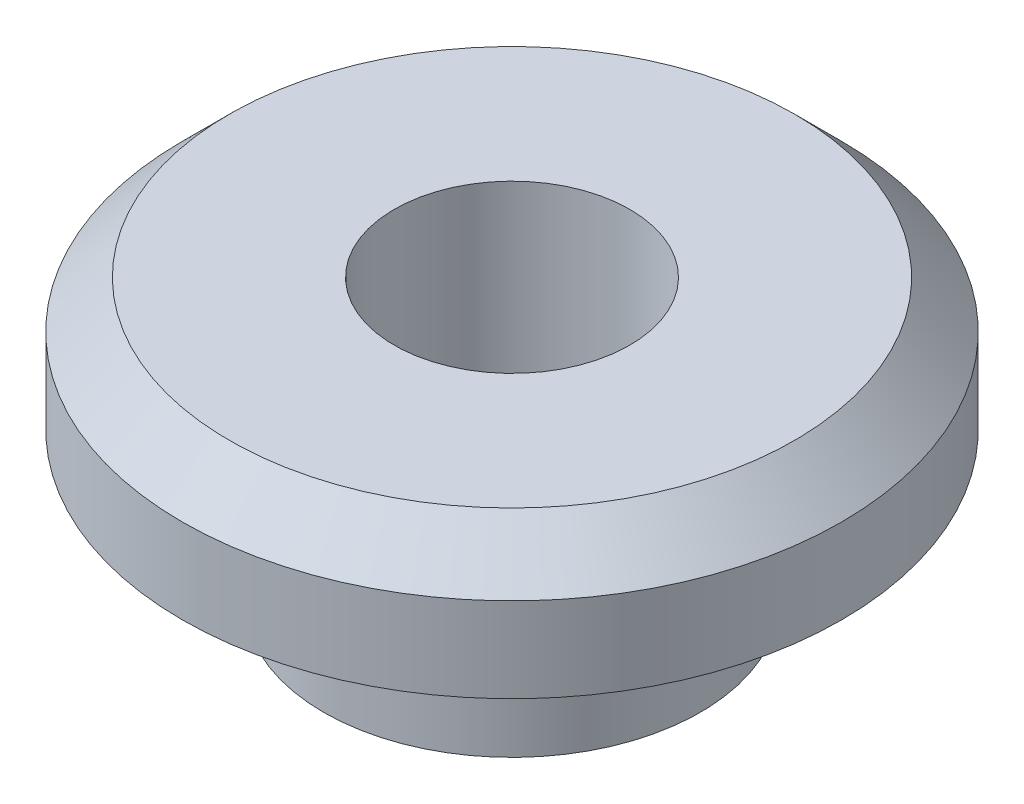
SolidWorks part; units mm, degrees
ref_plane "Front Plane" through (0, 0, 0) normal (0, 0, 1) x (1, 0, 0)
ref_plane "Top Plane" through (0, 0, 0) normal (0, 1, 0) x (1, 0, 0)
ref_plane "Right Plane" through (0, 0, 0) normal (1, 0, 0) x (0, 0, -1)
sketch "Sketch1" plane through (0, 0, 0) normal (0, 0, 1) x (1, 0, 0)
  line L0 (0, 0) -> (0, 31.8234) construction
  line L1 (2.5, 6) -> (6, 6)
  line L2 (6, 6) -> (7, 5)
  line L3 (7, 5) -> (7, 3.2)
  line L4 (7, 3.2) -> (4, 3.2)
  line L5 (4, 3.2) -> (4, 0)
  line L6 (4, 0) -> (2.5, 0)
  line L7 (2.5, 0) -> (2.5, 6)
  dimension "D1" = 3.2
  dimension "D2" = 2.5
  dimension "D3" = 4
  dimension "D4" = 135
  dimension "D5" = 1
  dimension "D6" = 7
  dimension "D7" = 6
revolve "Revolve1" add sketch "Sketch1" angle 360 about L0
